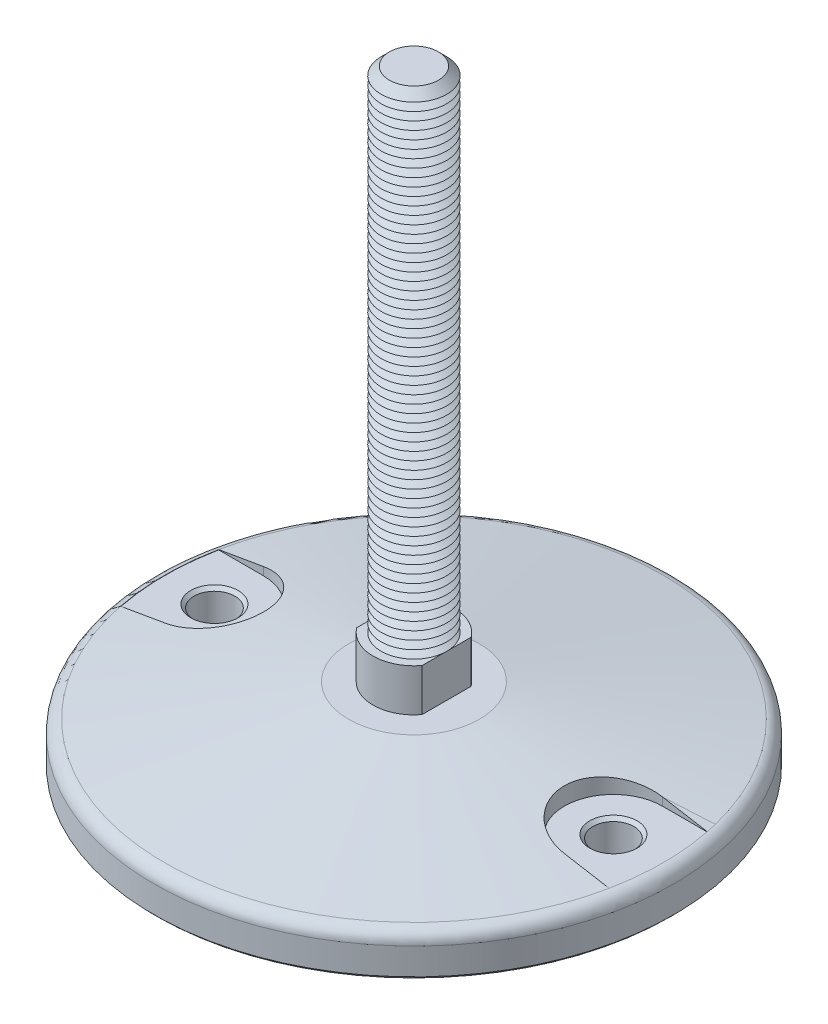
SolidWorks part; units mm, degrees
ref_plane "Front Plane" through (0, 0, 0) normal (0, 0, 1) x (1, 0, 0)
ref_plane "Top Plane" through (0, 0, 0) normal (0, 1, 0) x (1, 0, 0)
ref_plane "Right Plane" through (0, 0, 0) normal (1, 0, 0) x (0, 0, -1)
sketch "Sketch1" plane through (0, 0, 0) normal (1, 0, 0) x (0, 0, -1)
  line L0 (0, 61.3389) -> (0, -58.404) construction
sketch "Sketch2" plane through (0, 0, 0) normal (1, 0, 0) x (0, 0, -1)
  line L0 (0, 0) -> (-20, 0)
  line L1 (-20, 0) -> (-79.5, -10.4915)
  line L2 (-79.5, -10.4915) -> (-79.5, -23)
  line L3 (-79.5, -23) -> (0, -23)
  line L4 (0, 61.3389) -> (0, -58.404) construction
  line L5 (0, -23) -> (0, 0)
  dimension "D1" = 23
  dimension "D2" = 79.5
  dimension "D3" = 20
  dimension "D4" = 10
revolve "Revolve1" add sketch "Sketch2" angle 360 about L0
fillet "Fillet1" radius 4 1 edges at (0, -10.4915, 79.5)
sketch "Sketch3" plane through (0, 0, 0) normal (0, 1, 0) x (1, 0, 0)
  circle A0 centre (0, 0) radius 12.5
  dimension "D1" = 25
extrude "Boss-Extrude1" add sketch "Sketch3" along normal blind 13
sketch "Sketch4" plane through (0, 13, 0) normal (0, 1, 0) x (1, 0, 0)
  line L0 (-10, 7.5) -> (-10, -7.5)
  line L2 (10, -7.5) -> (10, 7.5)
  arc A0 (-10, 7.5) -> (-10, -7.5) centre (0, 0) ccw
  circle A1 centre (0, 0) radius 12.5 construction
  arc A2 (10, -7.5) -> (10, 7.5) centre (0, 0) ccw
  dimension "D1" = 20
extrude "Cut-Extrude1" cut sketch "Sketch4" against normal blind 13
sketch "Sketch5" plane through (0, 13, 0) normal (0, 1, 0) x (1, 0, 0)
  circle A0 centre (0, 0) radius 10
  dimension "D1" = 20
extrude "Boss-Extrude2" add sketch "Sketch5" along normal blind 150
chamfer "Chamfer1" distance 2.5 angle 45 1 edges at (0, 163, 10)
sketch "Sketch6" plane through (0, 0, 0) normal (1, 0, 0) x (0, 0, -1)
  line L0 (-10, 13) -> (-7.8349, 14.25)
  line L1 (-7.8349, 14.25) -> (-10, 15.5)
  line L2 (-10, 160.5) -> (-10, 13) construction
  line L3 (-10, 15.5) -> (-10, 13)
  dimension "D1" = 2.5
revolve "Cut-Revolve1" cut sketch "Sketch6" angle 360 about L0
pattern_linear "LPattern1" count 59 spacing 2.5 along (0, 1, 0) of "Cut-Revolve1"
sketch "Sketch8" plane through (0, 0, 0) normal (0, 1, 0) x (1, 0, 0)
  line L0 (-61, 15) -> (-74.7035, 15)
  line L1 (-61, -15) -> (-74.7035, -15)
  arc A1 (-74.7035, 15) -> (-74.7035, -15) centre (0, 0) ccw
  circle A2 centre (0, 0) radius 76.1946 construction
  arc A3 (-61, -15) -> (-61, 15) centre (-61, 0) ccw
  point P3 (-61, 0)
  point P11 (0, 0)
  dimension "D1" = 61
  dimension "D2" = 30
extrude "Cut-Extrude4" cut sketch "Sketch8" against normal blind 10
sketch "Sketch10" plane through (0, -10, 0) normal (0, 1, 0) x (1, 0, 0)
  circle A0 centre (-61, 0) radius 6.25
  dimension "D1" = 12.5
extrude "Cut-Extrude5" cut sketch "Sketch10" against normal up to surface (13 mm away)
chamfer "Chamfer2" distance 1 angle 45 2 edges at (-61, -23, -6.25) (-61, -10, 6.25)
mirror "Mirror1" about plane through (0, 0, 0) normal (1, 0, 0) of "Chamfer2", "Cut-Extrude5", "Cut-Extrude4"
chamfer "Chamfer3" distance 1 angle 45 1 edges at (0, -23, 79.5)
